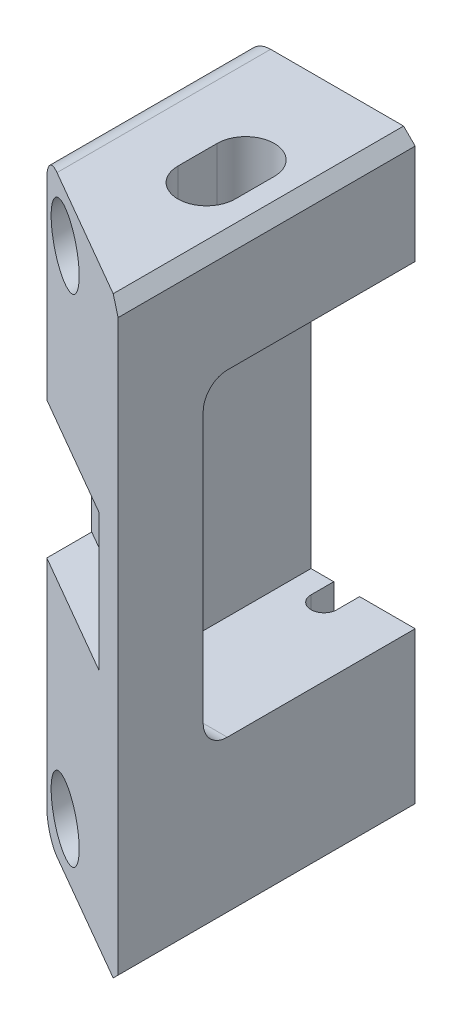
SolidWorks part; units mm, degrees
ref_plane "Front" through (0, 0, 0) normal (0, 0, 1) x (1, 0, 0)
ref_plane "Top" through (0, 0, 0) normal (0, 1, 0) x (1, 0, 0)
ref_plane "Right" through (0, 0, 0) normal (1, 0, 0) x (0, 0, -1)
imported_body "Imported1"
other "Move Face1" parameters "D1"=0.508
other "Move Face2" parameters "D1"=0.508
other "Move Face3" parameters "D1"=2.0574
other "Move Face4" parameters "D1"=2.0574
other "Move Face5" parameters "D1"=3.175
fillet "Fillet1" radius 2.3876 2 edges at (-287.1851, -28.3058, -43.815) (-291.9603, -28.3058, -43.815)
sketch "Sketch1" plane through (0, 39.0525, 0) normal (0, 1, 0) x (1, 0, 0)
  line L0 (-292.3778, 38.862) -> (-292.3778, 31.369)
  line L1 (-284.8372, 38.862) -> (-284.8372, 31.369)
  circle A0 centre (-288.6075, 38.862) radius 3.7703 construction
  arc A1 (-284.8372, 38.862) -> (-292.3778, 38.862) centre (-288.6075, 38.862) ccw
  arc A2 (-292.3778, 31.369) -> (-284.8372, 31.369) centre (-288.6075, 31.369) ccw
  dimension "D1" = 7.493
extrude "Cut-Extrude1" cut sketch "Sketch1" against normal blind 16.764
sketch "Sketch3" plane through (-303.53, 0, 0) normal (-1, 0, 0) x (0, 0, 1)
  line L0 (-50.8, -35.8775) -> (-50.8, 35.8775) construction
  line L1 (-50.8, 27.1792) -> (-38.5454, 27.1792)
  line L2 (-50.8, 27.1792) -> (-50.8, -22.5095)
  line L3 (-50.8, -22.5095) -> (-38.5454, -22.5095)
  line L4 (-38.5454, 27.1792) -> (-38.5454, -22.5095)
extrude "Boss-Extrude1" add sketch "Sketch3" against normal blind 2.54
sketch "Sketch2" plane through (-303.53, 0, 0) normal (-1, 0, 0) x (0, 0, 1)
  line L0 (2.4987, -7.62) -> (-71.2525, -7.62) construction
  line L1 (-50.8, 0) -> (-17.5906, 0) construction
  line L3 (-50.8, -35.8775) -> (-50.8, 35.8775) construction
  point P7 (-43.2593, -7.62)
  line B0 (-40.1024, -7.62) -> (-19.8297, -7.62) construction
  line B1 (-43.2593, 24.13) -> (-43.2593, -39.37) construction
  line B2 (-43.2593, 24.13) -> (-21.0524, 24.13) construction
  line B3 (-43.2593, -39.37) -> (-21.6752, -39.37) construction
  line B4 (-36.9093, 24.13) -> (-36.9093, -39.37) construction
  line B5 (-49.6093, 24.13) -> (-49.6093, -39.37) construction
sketch_block_instance "Block1-1"
sketch_block "Block1" parameters "D1"=38.1, "D2"=6.35, "D3"=6.35, "D4"=20.2727, "D5"=63.5
extrude "Cut-Extrude2" cut sketch "Sketch2" against normal blind 0.762
other "Move Face6" parameters "D1"=2.3343
other "Move Face8" parameters "D1"=0.762
other "Move Face9" parameters "D1"=0.6858
other "Move Face10" parameters "D1"=1.6002
sketch "Sketch4" plane through (0, -39.0525, 0) normal (0, -1, 0) x (1, 0, 0)
  line L0 (-291.2745, -50.8) -> (-287.8709, -50.8)
  line L1 (-289.5727, -46.101) -> (-289.5727, -50.8)
  arc A0 (-287.8709, -47.8028) -> (-289.5727, -46.101) centre (-289.5727, -47.8028) ccw construction
  arc A1 (-287.8709, -47.8028) -> (-289.5727, -46.101) centre (-289.5727, -47.8028) ccw
  dimension "D1" = 4.699
other "Move Face11" parameters "D1"=1.524
other "Move Face12" parameters "D1"=2.54
other "Move Face13" parameters "D1"=1.524
other "Move Face14" parameters "D1"=0.762
move or copy body "Body-Move/Copy1" bodies to move or copy 119 copy no translate (0, -1.5875, 0) parameters "D1"=0, "D2"=1.5875, "D3"=0
hole_wizard "Hole1" positions "Point_Sketch" profile "Profil_Sketch" hole size "Ø0.15" standard "ISO"
sketch "Point_Sketch" plane through (-301.4693, 41.7161, -30.4293) normal (0, 0, -1) x (1, 0, 0)
  point P0 (3.6543, 10.6011)
  point P2 (3.6543, 76.0061)
sketch "Profil_Sketch" plane through (-297.815, 31.115, -30.4293) normal (1, 0, 0) x (0, -1, 0)
  line L0 (0, 0) -> (0, 20.3707)
  line L1 (0, 20.3707) -> (2.8067, 20.3707)
  line L2 (2.8067, 20.3707) -> (2.8067, 0)
  line L5 (2.8067, 0) -> (0, 0)
  line L11 (0, -6.35) -> (0, 107.95) construction
  dimension "Diameter" = 5.6134
  dimension "Thru Hole Depth" = 20.3707
other "usin_DL090_10-24x1.25-SHCS<1>"
